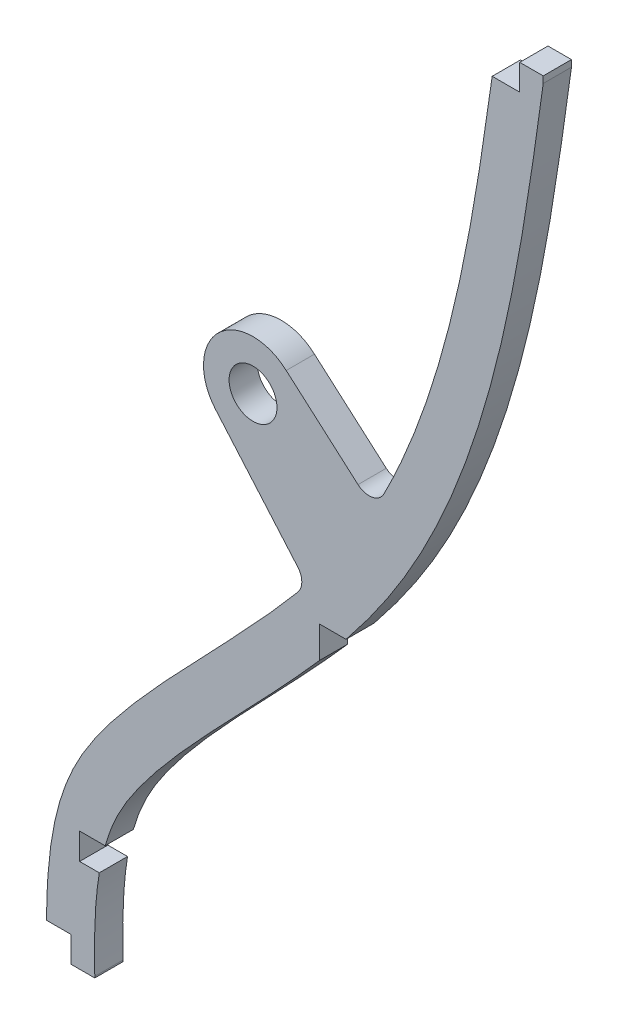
SolidWorks part; units mm, degrees
ref_plane "Front Plane" through (0, 0, 0) normal (0, 0, 1) x (1, 0, 0)
ref_plane "Top Plane" through (0, 0, 0) normal (0, 1, 0) x (1, 0, 0)
ref_plane "Right Plane" through (0, 0, 0) normal (1, 0, 0) x (0, 0, -1)
sketch "Sketch2" plane through (0, 0, 0) normal (0, 0, 1) x (1, 0, 0)
  line L0 (0, 0) -> (0, 106.68) construction
  line L1 (0, 0) -> (-76.2, 0) construction
  line L2 (0, 106.68) -> (-28.575, 106.68) construction
  line L3 (0, 0) -> (0, 106.68) construction
  line L4 (-75.27, 12.7) -> (0, 12.7) construction
  line L5 (-51.0976, 44.45) -> (0, 44.45) construction
  line L6 (-71.1223, 0.1523) -> (-71.1223, 0)
  line L7 (-71.1223, 0) -> (-76.2, 0)
  line L8 (-28.575, 106.68) -> (-23.5432, 106.68)
  line L10 (-23.5432, 105.9822) -> (-23.5432, 106.68)
  spline S0 degree 3 poles (-76.2, 0) (-76.5697, 12.3264) (-70.4254, 26.7635) (-35.695, 54.9593) (-31.1223, 88.3123) (-28.575, 106.68) knots 0 0 0 0 0.192928 0.526147 1 1 1 1
  spline S1 degree 1 poles (-71.1223, 0.1523) (-23.5432, 105.9822) knots 0 0 1 1 construction
  spline S2 degree 3 poles (-71.1223, 0.1523) (-71.1361, 0.6121) (-71.1567, 1.5498) (-71.1646, 3.2821) (-71.1168, 5.2862) (-70.9731, 7.4216) (-70.6767, 9.951) (-70.1306, 12.5718) (-69.2454, 15.1046) (-68.1202, 17.3344) (-66.6722, 19.5511) (-64.8631, 21.9349) (-62.1184, 25.2082) (-58.1372, 29.5028) (-52.8597, 34.9642) (-47.4482, 40.7915) (-42.2515, 47.0605) (-37.6918, 53.9253) (-34.0642, 61.0843) (-31.1698, 68.4658) (-28.9001, 75.9825) (-27.1227, 83.5631) (-25.7154, 91.1411) (-24.7522, 97.394) (-24.0486, 102.3357) (-23.7122, 104.7629) (-23.5432, 105.9822) knots 0 0 0 0 0.007812 0.015625 0.03125 0.046875 0.0625 0.09375 0.125 0.15625 0.1875 0.21875 0.25 0.3125 0.375 0.4375 0.5 0.5625 0.625 0.6875 0.75 0.8125 0.875 0.9375 0.96875 1 1 1 1
  dimension "D1" = 106.68
  dimension "D2" = 28.575
  dimension "D3" = 76.2
  dimension "D4" = 12.7
  dimension "D5" = 44.45
  dimension "D6" = 75.27
  dimension "D7" = 51.0976
  dimension "D8" = 5.08
extrude "Boss-Extrude1" add sketch "Sketch2" along normal blind 2.9972
sketch "Sketch3" plane through (0, 0, 2.9972) normal (0, 0, 1) x (1, 0, 0)
  line L0 (-73.66, 0) -> (-73.66, 2.7432)
  line L1 (-71.1223, 0) -> (-76.2, 0) construction
  line L2 (-73.66, 2.7432) -> (-76.2391, 2.7432)
  line L3 (-73.66, 0) -> (-76.5672, 0)
  line L4 (-76.5672, 0) -> (-76.2391, 2.7432)
  line L5 (-70.0285, 12.7) -> (-72.73, 12.7)
  line L6 (-75.27, 12.7) -> (0, 12.7) construction
  line L7 (-72.73, 12.7) -> (-72.73, 9.906)
  line L8 (-72.73, 9.906) -> (-70.643, 9.906)
  line L9 (-70.643, 9.906) -> (-70.0285, 12.7)
  line L10 (-44.4594, 44.45) -> (-47.2876, 44.45)
  line L11 (-51.0976, 44.45) -> (0, 44.45) construction
  line L12 (-47.2876, 44.45) -> (-47.2876, 41.0895)
  line L13 (-47.2876, 41.0895) -> (-44.4594, 41.0895)
  line L14 (-44.4594, 41.0895) -> (-44.4594, 44.45)
  line L15 (-26.035, 106.68) -> (-26.035, 103.9368)
  line L16 (-28.575, 106.68) -> (-23.5432, 106.68) construction
  line L17 (-26.035, 103.9368) -> (-28.9563, 103.9368)
  line L18 (-28.9563, 103.9368) -> (-28.9563, 106.68)
  line L19 (-28.9563, 106.68) -> (-26.035, 106.68)
  spline S0 degree 3 poles (-76.2, 0) (-76.5697, 12.3264) (-70.4254, 26.7635) (-35.695, 54.9593) (-31.1223, 88.3123) (-28.575, 106.68) knots 0 0 0 0 0.192928 0.526147 1 1 1 1 construction
  spline S1 degree 3 poles (-71.1223, 0.1523) (-71.1361, 0.6121) (-71.1567, 1.5498) (-71.1646, 3.2821) (-71.1168, 5.2862) (-70.9731, 7.4216) (-70.6767, 9.951) (-70.1306, 12.5718) (-69.2454, 15.1046) (-68.1202, 17.3344) (-66.6722, 19.5511) (-64.8631, 21.9349) (-62.1184, 25.2082) (-58.1372, 29.5028) (-52.8597, 34.9642) (-47.4482, 40.7915) (-42.2515, 47.0605) (-37.6918, 53.9253) (-34.0642, 61.0843) (-31.1698, 68.4658) (-28.9001, 75.9825) (-27.1227, 83.5631) (-25.7154, 91.1411) (-24.7522, 97.394) (-24.0486, 102.3357) (-23.7122, 104.7629) (-23.5432, 105.9822) knots 0 0 0 0 0.007812 0.015625 0.03125 0.046875 0.0625 0.09375 0.125 0.15625 0.1875 0.21875 0.25 0.3125 0.375 0.4375 0.5 0.5625 0.625 0.6875 0.75 0.8125 0.875 0.9375 0.96875 1 1 1 1 construction
  dimension "D1" = 2.54
  dimension "D2" = 2.7432
  dimension "D3" = 2.54
  dimension "D4" = 2.794
  dimension "D5" = 3.81
  dimension "D6" = 2.54
  dimension "D7" = 2.7432
extrude "Cut-Extrude1" cut sketch "Sketch3" against normal blind 2.9972
sketch "Sketch4" plane through (0, 0, 2.9972) normal (0, 0, 1) x (1, 0, 0)
  line L0 (-58.3361, 58.6813) -> (-47.446, 46.0533)
  line L1 (-47.446, 46.0533) -> (-39.0309, 55.6532)
  line L2 (-39.0309, 55.6532) -> (-50.8086, 65.9772)
  arc A0 (-58.3361, 58.6813) -> (-50.8086, 65.9772) centre (-54.3318, 62.081) cw
  circle A1 centre (-54.3318, 62.081) radius 2.54
  dimension "D1" = 5.08
extrude "Boss-Extrude2" add sketch "Sketch4" against normal blind 2.9972
fillet "Fillet2" radius 1.778 2 edges at (-48.6089, 47.4018, 1.4986) (-41.5049, 57.8218, 1.4986)
